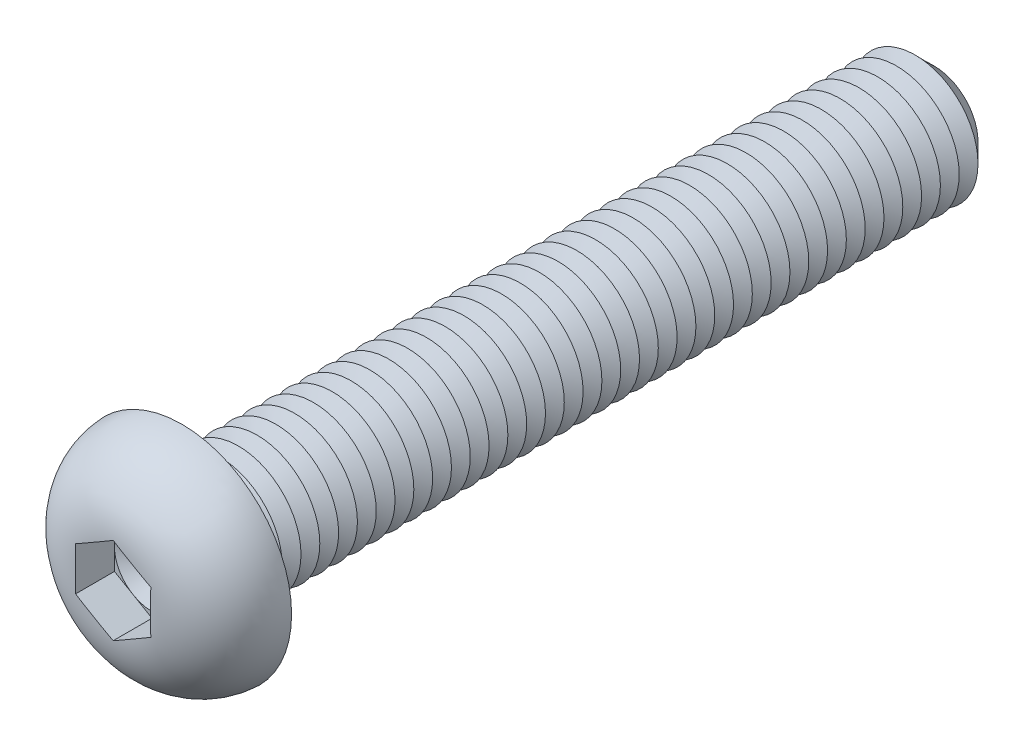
SolidWorks part; units mm, degrees
ref_plane "Front Plane" through (0, 0, 0) normal (0, 0, 1) x (1, 0, 0)
ref_plane "Top Plane" through (0, 0, 0) normal (0, 1, 0) x (1, 0, 0)
ref_plane "Right Plane" through (0, 0, 0) normal (1, 0, 0) x (0, 0, -1)
sketch "Sketch1" plane through (0, 0, 0) normal (1, 0, 0) x (0, 0, -1)
  line L0 (-47.9342, 0) -> (60.3146, 0) construction
sketch "Sketch2" plane through (0, 0, 0) normal (1, 0, 0) x (0, 0, -1)
  line L0 (0, 0) -> (-5.5, 0)
  line L1 (-47.9342, 0) -> (60.3146, 0) construction
  line L2 (-5.5, 0) -> (-5.5, 2.9578)
  line L3 (0, 8.75) -> (0, 0)
  arc A0 (-5.5, 2.9578) -> (0, 8.75) centre (0.3, 2.9578) cw
  dimension "D1" = 5.8
  dimension "D2" = 5.5
  dimension "D3" = 8.75
revolve "Revolve1" add sketch "Sketch2" angle 360 about L0
sketch "Sketch3" plane through (0, 0, 5.5) normal (0, 0, 1) x (1, 0, 0)
  line L1 (0, 3.4641) -> (-3, 1.7321)
  line L2 (-3, 1.7321) -> (-3, -1.7321)
  line L3 (-3, -1.7321) -> (0, -3.4641)
  line L4 (0, -3.4641) -> (3, -1.7321)
  line L5 (3, -1.7321) -> (3, 1.7321)
  line L6 (3, 1.7321) -> (0, 3.4641)
  circle A0 centre (0, 0) radius 3 construction
  dimension "D1" = 6
extrude "Cut-Extrude1" cut sketch "Sketch3" against normal blind 3.12
sketch "Sketch4" plane through (0, 0, 0) normal (0, 0, -1) x (-1, 0, 0)
  circle A0 centre (0, 0) radius 5
  dimension "D1" = 10
extrude "Boss-Extrude1" add sketch "Sketch4" along normal blind 60
chamfer "Chamfer1" distance 1.5 angle 45 1 edges at (-5, 0, -60)
sketch "Sketch5" plane through (0, 0, 0) normal (1, 0, 0) x (0, 0, -1)
  line L0 (1.5, 5) -> (3, 5)
  line L1 (58.5, 5) -> (0, 5) construction
  line L2 (3, 5) -> (2.25, 3.701)
  line L3 (2.25, 3.701) -> (1.5, 5)
  line L4 (0, -8.75) -> (0, 8.75) construction
  line L5 (58.5, 5) -> (0, 5) construction
  dimension "D1" = 1.5
  dimension "D2" = 1.5
revolve "Cut-Revolve1" cut sketch "Sketch5" angle 360 about L0
pattern_linear "LPattern1" count 38 spacing 1.5 along (0, 0, -1) of "Cut-Revolve1"
fillet "Fillet2" radius 0.6 1 edges at (5, 0, 0)
sketch "Sketch6" plane through (0, 0, 2.38) normal (0, 0, 1) x (1, 0, 0)
  line L0 (0, -3.4641) -> (3, -1.7321) construction
  circle A0 centre (0, 0) radius 3
extrude "Cut-Extrude2" cut sketch "Sketch6" against normal through all draft 60
